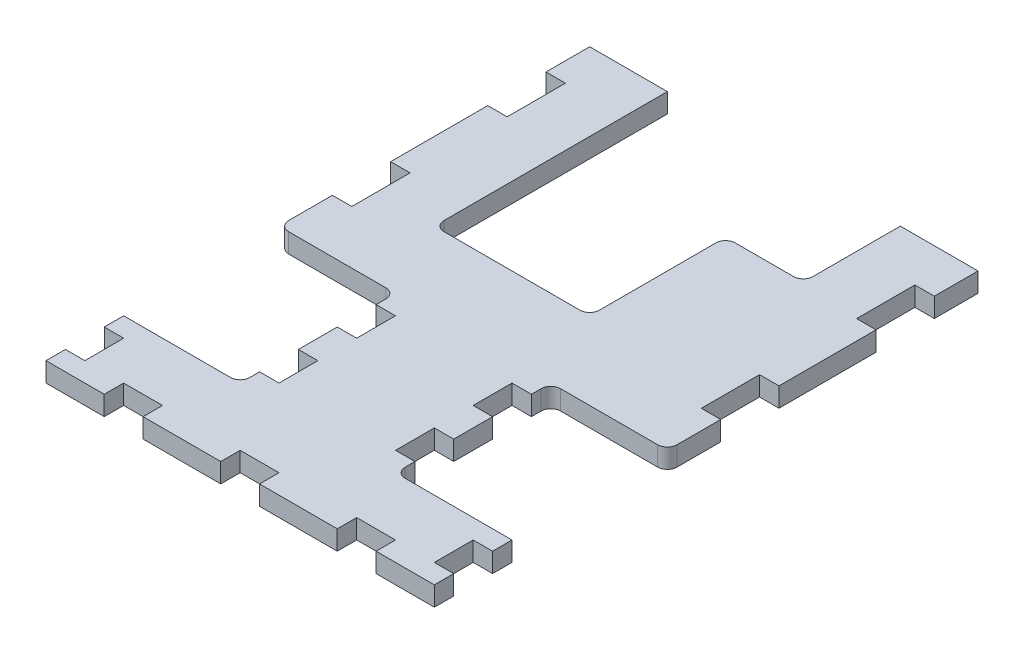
SolidWorks part; units mm, degrees
ref_plane "Front Plane" through (0, 0, 0) normal (0, 0, 1) x (1, 0, 0)
ref_plane "Top Plane" through (0, 0, 0) normal (0, 1, 0) x (1, 0, 0)
ref_plane "Right Plane" through (0, 0, 0) normal (1, 0, 0) x (0, 0, -1)
sketch "Sketch1" plane through (0, 0, 0) normal (0, 1, 0) x (1, 0, 0)
  line L0 (-38.1, 76.2) -> (-38.1, 0)
  line L1 (-38.1, 0) -> (12.7, 0)
  line L2 (38.1, 44.45) -> (38.1, 76.2)
  line L3 (38.1, 76.2) -> (63.5, 76.2)
  line L4 (63.5, 76.2) -> (63.5, -25.4)
  line L5 (63.5, -25.4) -> (25.4, -25.4)
  line L6 (25.4, -25.4) -> (25.4, -76.2)
  line L7 (25.4, -76.2) -> (63.5, -76.2)
  line L8 (63.5, -76.2) -> (63.5, -101.6)
  line L9 (63.5, -101.6) -> (-63.5, -101.6)
  line L10 (-63.5, -101.6) -> (-63.5, -76.2)
  line L11 (-63.5, -76.2) -> (-25.4, -76.2)
  line L12 (-25.4, -76.2) -> (-25.4, -25.4)
  line L13 (-25.4, -25.4) -> (-63.5, -25.4)
  line L14 (-63.5, -25.4) -> (-63.5, 76.2)
  line L15 (-63.5, 76.2) -> (-38.1, 76.2)
  line L16 (0, 0) -> (0, -101.6) construction
  line L17 (12.7, 0) -> (12.7, 44.45)
  line L18 (12.7, 44.45) -> (38.1, 44.45)
  dimension "D1" = 25.4
  dimension "D2" = 76.2
  dimension "D3" = 127
  dimension "D4" = 25.4
  dimension "D5" = 152.4
  dimension "D6" = 25.4
  dimension "D7" = 50.8
  dimension "D8" = 44.45
  dimension "D9" = 25.4
extrude "Boss-Extrude1" add sketch "Sketch1" along normal mid plane 6.35
fillet "Fillet1" radius 3.175 10 edges at (63.5, 0, 25.4) (25.4, 0, 25.4) (25.4, 0, 76.2) (-25.4, 0, 76.2) (-25.4, 0, 25.4) (-63.5, 0, 25.4) (12.7, 0, 0) (38.1, 0, -44.45) (12.7, 0, -44.45) (-38.1, 0, 0)
sketch "Sketch2" plane through (0, 3.175, 0) normal (0, 1, 0) x (1, 0, 0)
  line L0 (-63.5, 76.2) -> (-63.5, -22.225) construction
  line L1 (-63.5, 61.9125) -> (-57.15, 61.9125)
  line L2 (-63.5, 61.9125) -> (-63.5, 42.8625)
  line L3 (-63.5, 42.8625) -> (-57.15, 42.8625)
  line L4 (-57.15, 61.9125) -> (-57.15, 42.8625)
  line L5 (-63.5, -76.2) -> (-63.5, -101.6) construction
  line L6 (-63.5, 11.1125) -> (-57.15, 11.1125)
  line L7 (-63.5, 11.1125) -> (-63.5, -7.9375)
  line L8 (-63.5, -7.9375) -> (-57.15, -7.9375)
  line L9 (-57.15, 11.1125) -> (-57.15, -7.9375)
  line L10 (-63.5, -82.55) -> (-57.15, -82.55)
  line L11 (-63.5, -82.55) -> (-63.5, -95.25)
  line L12 (-63.5, -95.25) -> (-57.15, -95.25)
  line L13 (-57.15, -82.55) -> (-57.15, -95.25)
  line L14 (0, 0) -> (0, 36.3657) construction
  line L15 (-63.5, -101.6) -> (63.5, -101.6) construction
  line L16 (-63.5, 76.2) -> (-63.5, -22.225) construction
  line L17 (-44.45, -101.6) -> (-31.75, -101.6)
  line L18 (-57.15, 42.8625) -> (-57.15, 11.1125) construction
  line L19 (-57.15, 26.9875) -> (-63.5, 26.9875) construction
  line L20 (-63.5, -88.9) -> (-57.15, -88.9) construction
  line L21 (63.5, -88.9) -> (57.15, -88.9) construction
  line L22 (57.15, 26.9875) -> (63.5, 26.9875) construction
  line L23 (57.15, 42.8625) -> (57.15, 11.1125) construction
  line L24 (63.5, 76.2) -> (63.5, -22.225) construction
  line L25 (57.15, -82.55) -> (57.15, -95.25)
  line L26 (63.5, -95.25) -> (57.15, -95.25)
  line L27 (63.5, -82.55) -> (63.5, -95.25)
  line L28 (63.5, -82.55) -> (57.15, -82.55)
  line L29 (57.15, 11.1125) -> (57.15, -7.9375)
  line L30 (63.5, -7.9375) -> (57.15, -7.9375)
  line L31 (63.5, 11.1125) -> (63.5, -7.9375)
  line L32 (63.5, 11.1125) -> (57.15, 11.1125)
  line L33 (57.15, 61.9125) -> (57.15, 42.8625)
  line L34 (63.5, 42.8625) -> (57.15, 42.8625)
  line L35 (63.5, 61.9125) -> (63.5, 42.8625)
  line L36 (63.5, 61.9125) -> (57.15, 61.9125)
  line L37 (-25.4, -28.575) -> (-25.4, -73.025) construction
  line L38 (-25.4, -31.75) -> (-19.05, -31.75)
  line L39 (-25.4, -31.75) -> (-25.4, -44.45)
  line L40 (-25.4, -44.45) -> (-19.05, -44.45)
  line L41 (-19.05, -31.75) -> (-19.05, -44.45)
  line L42 (-28.575, -25.4) -> (28.575, -25.4) construction
  line L43 (-25.4, -57.15) -> (-19.05, -57.15)
  line L44 (-25.4, -57.15) -> (-25.4, -69.85)
  line L45 (-25.4, -69.85) -> (-19.05, -69.85)
  line L46 (-19.05, -57.15) -> (-19.05, -69.85)
  line L47 (-28.575, -76.2) -> (28.575, -76.2) construction
  line L48 (0, -25.4) -> (0, -76.2) construction
  line L49 (-19.05, -44.45) -> (-19.05, -57.15) construction
  line L50 (0, -50.8) -> (-19.05, -50.8) construction
  line L51 (19.05, -44.45) -> (19.05, -57.15) construction
  line L52 (19.05, -57.15) -> (19.05, -69.85)
  line L53 (25.4, -69.85) -> (19.05, -69.85)
  line L54 (25.4, -57.15) -> (25.4, -69.85)
  line L55 (25.4, -57.15) -> (19.05, -57.15)
  line L56 (19.05, -31.75) -> (19.05, -44.45)
  line L57 (25.4, -44.45) -> (19.05, -44.45)
  line L58 (25.4, -31.75) -> (25.4, -44.45)
  line L59 (25.4, -31.75) -> (19.05, -31.75)
  line L60 (-44.45, -101.6) -> (-44.45, -95.25)
  line L61 (-44.45, -95.25) -> (-31.75, -95.25)
  line L62 (-31.75, -101.6) -> (-31.75, -95.25)
  line L63 (-31.75, -95.25) -> (-6.35, -95.25) construction
  line L64 (-6.35, -101.6) -> (6.35, -101.6)
  line L65 (-6.35, -101.6) -> (-6.35, -95.25)
  line L66 (-6.35, -95.25) -> (6.35, -95.25)
  line L67 (6.35, -101.6) -> (6.35, -95.25)
  line L68 (31.75, -101.6) -> (44.45, -101.6)
  line L69 (31.75, -101.6) -> (31.75, -95.25)
  line L70 (31.75, -95.25) -> (44.45, -95.25)
  line L71 (44.45, -101.6) -> (44.45, -95.25)
  line L72 (6.35, -95.25) -> (31.75, -95.25) construction
  dimension "D1" = 19.05
  dimension "D2" = 6.35
  dimension "D3" = 50.8
  dimension "D4" = 12.7
  dimension "D5" = 6.35
  dimension "D6" = 12.7
  dimension "D7" = 25.4
  dimension "D8" = 12.7
  dimension "D9" = 38.1
extrude "Cut-Extrude1" cut sketch "Sketch2" against normal up to surface (6.35 mm away)
sketch "Sketch3" plane through (0, 3.175, 0) normal (0, 1, 0) x (1, 0, 0)
  line L140 (31.8516, -95.3516) -> (44.3484, -95.3516)
  line L141 (44.3484, -95.3516) -> (44.3484, -101.7016)
  line L142 (44.3484, -101.7016) -> (63.6016, -101.7016)
  line L143 (63.6016, -101.7016) -> (63.6016, -95.1484)
  line L144 (63.6016, -95.1484) -> (57.2516, -95.1484)
  line L145 (57.2516, -95.1484) -> (57.2516, -82.6516)
  line L146 (57.2516, -82.6516) -> (63.6016, -82.6516)
  line L147 (63.6016, -82.6516) -> (63.6016, -76.0984)
  line L148 (63.6016, -76.0984) -> (28.575, -76.0984)
  line L149 (25.5016, -73.025) -> (25.5016, -69.7484)
  line L150 (25.5016, -69.7484) -> (19.1516, -69.7484)
  line L151 (19.1516, -69.7484) -> (19.1516, -57.2516)
  line L152 (19.1516, -57.2516) -> (25.5016, -57.2516)
  line L153 (25.5016, -57.2516) -> (25.5016, -44.3484)
  line L154 (25.5016, -44.3484) -> (19.1516, -44.3484)
  line L155 (19.1516, -44.3484) -> (19.1516, -31.8516)
  line L156 (19.1516, -31.8516) -> (25.5016, -31.8516)
  line L157 (25.5016, -31.8516) -> (25.5016, -28.575)
  line L158 (28.575, -25.5016) -> (60.325, -25.5016)
  line L159 (63.6016, -22.225) -> (63.6016, -7.8359)
  line L160 (63.6016, -7.8359) -> (57.2516, -7.8359)
  line L161 (57.2516, -7.8359) -> (57.2516, 11.0109)
  line L162 (57.2516, 11.0109) -> (63.6016, 11.0109)
  line L163 (63.6016, 11.0109) -> (63.6016, 42.9641)
  line L164 (63.6016, 42.9641) -> (57.2516, 42.9641)
  line L165 (57.2516, 42.9641) -> (57.2516, 61.8109)
  line L166 (57.2516, 61.8109) -> (63.6016, 61.8109)
  line L167 (63.6016, 61.8109) -> (63.6016, 76.3016)
  line L168 (63.6016, 76.3016) -> (37.9984, 76.3016)
  line L169 (37.9984, 76.3016) -> (37.9984, 47.625)
  line L170 (34.925, 44.5516) -> (15.875, 44.5516)
  line L171 (12.5984, 41.275) -> (12.5984, 3.175)
  line L172 (9.525, 0.1016) -> (-34.925, 0.1016)
  line L173 (-37.9984, 3.175) -> (-37.9984, 76.3016)
  line L174 (-37.9984, 76.3016) -> (-63.6016, 76.3016)
  line L175 (-63.6016, 76.3016) -> (-63.6016, 61.8109)
  line L176 (-63.6016, 61.8109) -> (-57.2516, 61.8109)
  line L177 (-57.2516, 61.8109) -> (-57.2516, 42.9641)
  line L178 (-57.2516, 42.9641) -> (-63.6016, 42.9641)
  line L179 (-63.6016, 42.9641) -> (-63.6016, 11.0109)
  line L180 (-63.6016, 11.0109) -> (-57.2516, 11.0109)
  line L181 (-57.2516, 11.0109) -> (-57.2516, -7.8359)
  line L182 (-57.2516, -7.8359) -> (-63.6016, -7.8359)
  line L183 (-63.6016, -7.8359) -> (-63.6016, -22.225)
  line L184 (-60.325, -25.5016) -> (-28.575, -25.5016)
  line L185 (-25.5016, -28.575) -> (-25.5016, -31.8516)
  line L186 (-25.5016, -31.8516) -> (-19.1516, -31.8516)
  line L187 (-19.1516, -31.8516) -> (-19.1516, -44.3484)
  line L188 (-19.1516, -44.3484) -> (-25.5016, -44.3484)
  line L189 (-25.5016, -44.3484) -> (-25.5016, -57.2516)
  line L190 (-25.5016, -57.2516) -> (-19.1516, -57.2516)
  line L191 (-19.1516, -57.2516) -> (-19.1516, -69.7484)
  line L192 (-19.1516, -69.7484) -> (-25.5016, -69.7484)
  line L193 (-25.5016, -69.7484) -> (-25.5016, -73.025)
  line L194 (-28.575, -76.0984) -> (-63.6016, -76.0984)
  line L195 (-63.6016, -76.0984) -> (-63.6016, -82.6516)
  line L196 (-63.6016, -82.6516) -> (-57.2516, -82.6516)
  line L197 (-57.2516, -82.6516) -> (-57.2516, -95.1484)
  line L198 (-57.2516, -95.1484) -> (-63.6016, -95.1484)
  line L199 (-63.6016, -95.1484) -> (-63.6016, -101.7016)
  line L200 (-63.6016, -101.7016) -> (-44.3484, -101.7016)
  line L201 (-44.3484, -101.7016) -> (-44.3484, -95.3516)
  line L202 (-44.3484, -95.3516) -> (-31.8516, -95.3516)
  line L203 (-31.8516, -95.3516) -> (-31.8516, -101.7016)
  line L204 (-31.8516, -101.7016) -> (-6.2484, -101.7016)
  line L205 (-6.2484, -101.7016) -> (-6.2484, -95.3516)
  line L206 (-6.2484, -95.3516) -> (6.2484, -95.3516)
  line L207 (6.2484, -95.3516) -> (6.2484, -101.7016)
  line L208 (6.2484, -101.7016) -> (31.8516, -101.7016)
  line L209 (31.8516, -101.7016) -> (31.8516, -95.3516)
  line L210 (31.8516, -95.3516) -> (44.3484, -95.3516)
  line L211 (44.3484, -95.3516) -> (44.3484, -101.7016)
  line L212 (44.3484, -101.7016) -> (63.6016, -101.7016)
  line L213 (63.6016, -101.7016) -> (63.6016, -95.1484)
  line L214 (63.6016, -95.1484) -> (57.2516, -95.1484)
  line L215 (57.2516, -95.1484) -> (57.2516, -82.6516)
  line L216 (57.2516, -82.6516) -> (63.6016, -82.6516)
  line L217 (63.6016, -82.6516) -> (63.6016, -76.0984)
  line L218 (63.6016, -76.0984) -> (28.575, -76.0984)
  line L219 (25.5016, -73.025) -> (25.5016, -69.7484)
  line L220 (25.5016, -69.7484) -> (19.1516, -69.7484)
  line L221 (19.1516, -69.7484) -> (19.1516, -57.2516)
  line L222 (19.1516, -57.2516) -> (25.5016, -57.2516)
  line L223 (25.5016, -57.2516) -> (25.5016, -44.3484)
  line L224 (25.5016, -44.3484) -> (19.1516, -44.3484)
  line L225 (19.1516, -44.3484) -> (19.1516, -31.8516)
  line L226 (19.1516, -31.8516) -> (25.5016, -31.8516)
  line L227 (25.5016, -31.8516) -> (25.5016, -28.575)
  line L228 (28.575, -25.5016) -> (60.325, -25.5016)
  line L229 (63.6016, -22.225) -> (63.6016, -7.8359)
  line L230 (63.6016, -7.8359) -> (57.2516, -7.8359)
  line L231 (57.2516, -7.8359) -> (57.2516, 11.0109)
  line L232 (57.2516, 11.0109) -> (63.6016, 11.0109)
  line L233 (63.6016, 11.0109) -> (63.6016, 42.9641)
  line L234 (63.6016, 42.9641) -> (57.2516, 42.9641)
  line L235 (57.2516, 42.9641) -> (57.2516, 61.8109)
  line L236 (57.2516, 61.8109) -> (63.6016, 61.8109)
  line L237 (63.6016, 61.8109) -> (63.6016, 76.3016)
  line L238 (63.6016, 76.3016) -> (37.9984, 76.3016)
  line L239 (37.9984, 76.3016) -> (37.9984, 47.625)
  line L240 (34.925, 44.5516) -> (15.875, 44.5516)
  line L241 (12.5984, 41.275) -> (12.5984, 3.175)
  line L242 (9.525, 0.1016) -> (-34.925, 0.1016)
  line L243 (-37.9984, 3.175) -> (-37.9984, 76.3016)
  line L244 (-37.9984, 76.3016) -> (-63.6016, 76.3016)
  line L245 (-63.6016, 76.3016) -> (-63.6016, 61.8109)
  line L246 (-63.6016, 61.8109) -> (-57.2516, 61.8109)
  line L247 (-57.2516, 61.8109) -> (-57.2516, 42.9641)
  line L248 (-57.2516, 42.9641) -> (-63.6016, 42.9641)
  line L249 (-63.6016, 42.9641) -> (-63.6016, 11.0109)
  line L250 (-63.6016, 11.0109) -> (-57.2516, 11.0109)
  line L251 (-57.2516, 11.0109) -> (-57.2516, -7.8359)
  line L252 (-57.2516, -7.8359) -> (-63.6016, -7.8359)
  line L253 (-63.6016, -7.8359) -> (-63.6016, -22.225)
  line L254 (-60.325, -25.5016) -> (-28.575, -25.5016)
  line L255 (-25.5016, -28.575) -> (-25.5016, -31.8516)
  line L256 (-25.5016, -31.8516) -> (-19.1516, -31.8516)
  line L257 (-19.1516, -31.8516) -> (-19.1516, -44.3484)
  line L258 (-19.1516, -44.3484) -> (-25.5016, -44.3484)
  line L259 (-25.5016, -44.3484) -> (-25.5016, -57.2516)
  line L260 (-25.5016, -57.2516) -> (-19.1516, -57.2516)
  line L261 (-19.1516, -57.2516) -> (-19.1516, -69.7484)
  line L262 (-19.1516, -69.7484) -> (-25.5016, -69.7484)
  line L263 (-25.5016, -69.7484) -> (-25.5016, -73.025)
  line L264 (-28.575, -76.0984) -> (-63.6016, -76.0984)
  line L265 (-63.6016, -76.0984) -> (-63.6016, -82.6516)
  line L266 (-63.6016, -82.6516) -> (-57.2516, -82.6516)
  line L267 (-57.2516, -82.6516) -> (-57.2516, -95.1484)
  line L268 (-57.2516, -95.1484) -> (-63.6016, -95.1484)
  line L269 (-63.6016, -95.1484) -> (-63.6016, -101.7016)
  line L270 (-63.6016, -101.7016) -> (-44.3484, -101.7016)
  line L271 (-44.3484, -101.7016) -> (-44.3484, -95.3516)
  line L272 (-44.3484, -95.3516) -> (-31.8516, -95.3516)
  line L273 (-31.8516, -95.3516) -> (-31.8516, -101.7016)
  line L274 (-31.8516, -101.7016) -> (-6.2484, -101.7016)
  line L275 (-6.2484, -101.7016) -> (-6.2484, -95.3516)
  line L276 (-6.2484, -95.3516) -> (6.2484, -95.3516)
  line L277 (6.2484, -95.3516) -> (6.2484, -101.7016)
  line L278 (6.2484, -101.7016) -> (31.8516, -101.7016)
  line L279 (31.8516, -101.7016) -> (31.8516, -95.3516)
  arc A20 (25.5016, -73.025) -> (28.575, -76.0984) centre (28.575, -73.025) ccw
  arc A21 (28.575, -25.5016) -> (25.5016, -28.575) centre (28.575, -28.575) ccw
  arc A22 (60.325, -25.5016) -> (63.6016, -22.225) centre (60.325, -22.225) ccw
  arc A23 (34.925, 44.5516) -> (37.9984, 47.625) centre (34.925, 47.625) ccw
  arc A24 (15.875, 44.5516) -> (12.5984, 41.275) centre (15.875, 41.275) ccw
  arc A25 (9.525, 0.1016) -> (12.5984, 3.175) centre (9.525, 3.175) ccw
  arc A26 (-37.9984, 3.175) -> (-34.925, 0.1016) centre (-34.925, 3.175) ccw
  arc A27 (-63.6016, -22.225) -> (-60.325, -25.5016) centre (-60.325, -22.225) ccw
  arc A28 (-25.5016, -28.575) -> (-28.575, -25.5016) centre (-28.575, -28.575) ccw
  arc A29 (-28.575, -76.0984) -> (-25.5016, -73.025) centre (-28.575, -73.025) ccw
  arc A30 (25.5016, -73.025) -> (28.575, -76.0984) centre (28.575, -73.025) ccw
  arc A31 (28.575, -25.5016) -> (25.5016, -28.575) centre (28.575, -28.575) ccw
  arc A32 (60.325, -25.5016) -> (63.6016, -22.225) centre (60.325, -22.225) ccw
  arc A33 (34.925, 44.5516) -> (37.9984, 47.625) centre (34.925, 47.625) ccw
  arc A34 (15.875, 44.5516) -> (12.5984, 41.275) centre (15.875, 41.275) ccw
  arc A35 (9.525, 0.1016) -> (12.5984, 3.175) centre (9.525, 3.175) ccw
  arc A36 (-37.9984, 3.175) -> (-34.925, 0.1016) centre (-34.925, 3.175) ccw
  arc A37 (-63.6016, -22.225) -> (-60.325, -25.5016) centre (-60.325, -22.225) ccw
  arc A38 (-25.5016, -28.575) -> (-28.575, -25.5016) centre (-28.575, -28.575) ccw
  arc A39 (-28.575, -76.0984) -> (-25.5016, -73.025) centre (-28.575, -73.025) ccw
  dimension "D1" = 0.1016
